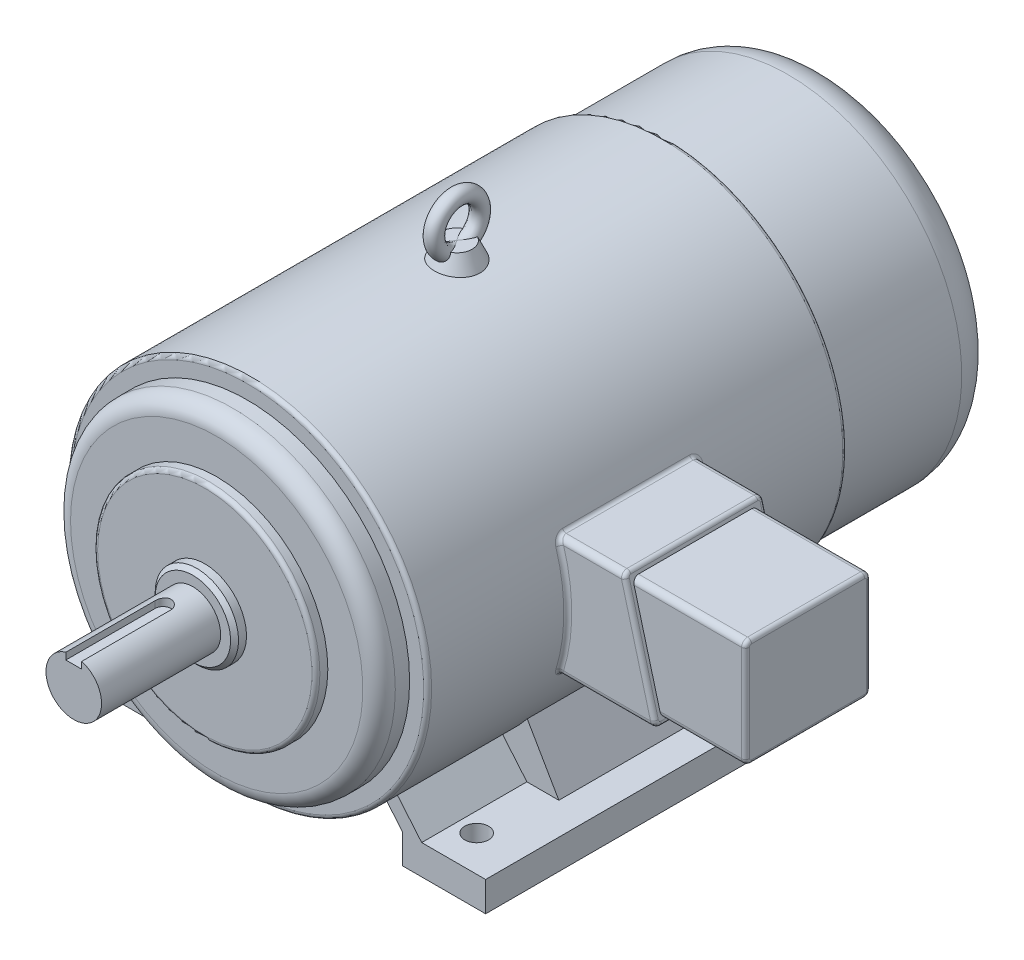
SolidWorks part; units mm, degrees
ref_plane "FRONT" through (0, 0, 0) normal (0, 0, 1) x (1, 0, 0)
ref_plane "TOP" through (0, 0, 0) normal (0, 1, 0) x (1, 0, 0)
ref_plane "RIGHT" through (0, 0, 0) normal (1, 0, 0) x (0, 0, -1)
sketch "Sketch1" plane through (0, 0, 0) normal (0, 0, 1) x (1, 0, 0)
  line L0 (-193, 0) -> (193, 0) construction
  line L1 (0, 103.8215) -> (0, -109.7499) construction
  line L2 (-105.6, -81.8182) -> (-121, -81.8182)
  line L3 (-105.6, 90.9091) -> (105.6, 90.9091)
  line L4 (-105.6, 90.9091) -> (-105.6, 81.8182)
  line L5 (-105.6, -90.9091) -> (105.6, -90.9091)
  line L6 (105.6, 90.9091) -> (105.6, -90.9091)
  line L7 (-121, -81.8182) -> (-121, -56)
  line L8 (-121, -56) -> (-127, -56)
  line L9 (-127, -56) -> (-127, -21)
  line L10 (-127, -21) -> (-133, -21)
  line L11 (-133, -21) -> (-133, -14)
  line L12 (-133, -14) -> (-193, -14)
  line L13 (-193, -14) -> (-193, 14)
  line L14 (-193, 14) -> (-133, 14)
  line L15 (-133, 14) -> (-133, 21)
  line L16 (-133, 21) -> (-127, 21)
  line L17 (-127, 21) -> (-127, 56)
  line L18 (-127, 56) -> (-121, 56)
  line L19 (-121, 56) -> (-121, 81.8182)
  line L20 (-121, 81.8182) -> (-105.6, 81.8182)
  line L21 (105.6, 90.9091) -> (187, 90.9091)
  line L22 (187, 90.9091) -> (187, 21)
  line L23 (187, -21) -> (193, -21)
  line L24 (193, -21) -> (193, 21)
  line L25 (193, 21) -> (187, 21)
  line L26 (-105.6, 87.4091) -> (187, 87.4091)
  line L27 (187, -90.9091) -> (105.6, -90.9091)
  line L28 (-105.6, -81.8182) -> (-105.6, -90.9091)
  line L29 (193, -14) -> (193, 14)
  line L30 (-133, 14) -> (193, 14) construction
  line L31 (193, -14) -> (-133, -14) construction
  line L32 (-88, -90.9091) -> (-88, -100)
  line L33 (-88, -100) -> (88, -100)
  line L34 (88, -100) -> (88, -90.9091)
  line L35 (-70, -90.9091) -> (-70, -100) construction
  line L36 (70, -90.9091) -> (70, -100) construction
  line L37 (-76, -90.9091) -> (-76, -100)
  line L40 (187, -21) -> (187, -90.9091)
  circle A0 centre (0, 124.7159) radius 20.2841
  dimension "D16" = 245
  dimension "D17" = 40.5682
  dimension "D1" = 181.8182
  dimension "D2" = 63
  dimension "D3" = 380
  dimension "D4" = 28
  dimension "D5" = 42
  dimension "D6" = 112
  dimension "D7" = 163.6364
  dimension "D8" = 60
  dimension "D9" = 6
  dimension "D10" = 176
  dimension "D11" = 211.2
  dimension "D12" = 140
  dimension "H" = 100
  dimension "D14" = 3.5
  dimension "D15" = 12
sketch "Sketch2" plane through (0, 0, 0) normal (0, 0, 1) x (1, 0, 0)
  line L0 (-193, 0) -> (193, 0) construction
  line L1 (193, -21) -> (193, 21) construction
  line L2 (193, 21) -> (187, 21) construction
  line L3 (187, 90.9091) -> (187, 21) construction
  line L4 (-133, 19) -> (-131, 21)
  line L5 (-105.6, 90.9091) -> (105.6, 90.9091) construction
  line L6 (-105.6, 90.9091) -> (-105.6, 81.8182) construction
  line L7 (-121, 81.8182) -> (-105.6, 81.8182) construction
  line L8 (-121, 56) -> (-121, 81.8182) construction
  line L9 (-127, 56) -> (-121, 56) construction
  line L10 (-127, 21) -> (-127, 56) construction
  line L11 (-133, 21) -> (-127, 21) construction
  line L12 (-133, 14) -> (-133, 21) construction
  line L13 (-193, -14) -> (-193, 14) construction
  line L14 (-193, 14) -> (-133, 14) construction
  line L15 (193, 0) -> (193, 19)
  line L16 (191, 21) -> (187, 21)
  line L17 (187, 67.4091) -> (187, 21)
  line L18 (-105.6, 87.4091) -> (187, 87.4091) construction
  line L19 (-103.6, 90.9091) -> (103.6, 90.9091)
  line L20 (-105.6, 88.9091) -> (-105.6, 81.8182)
  line L21 (-112.8182, 81.8182) -> (-105.6, 81.8182)
  line L22 (-121, 56) -> (-121, 73.6364)
  line L23 (-125, 56) -> (-121, 56)
  line L24 (-127, 21) -> (-127, 54)
  line L25 (-131, 21) -> (-127, 21)
  line L26 (-133, 14) -> (-133, 19)
  line L27 (-193, 0) -> (-193, 14)
  line L28 (-193, 14) -> (-133, 14)
  line L29 (193, 0) -> (-193, 0)
  line L30 (105.6, 90.9091) -> (105.6, -90.9091) construction
  line L31 (105.6, 87.4091) -> (167, 87.4091)
  line L33 (105.6, 88.9091) -> (105.6, 87.4091)
  arc A0 (-121, 73.6364) -> (-112.8182, 81.8182) centre (-112.8182, 73.6364) cw
  arc A1 (187, 67.4091) -> (167, 87.4091) centre (167, 67.4091) ccw
  arc A2 (105.6, 88.9091) -> (103.6, 90.9091) centre (103.6, 88.9091) ccw
  arc A3 (-125, 56) -> (-127, 54) centre (-125, 54) ccw
  arc A4 (193, 19) -> (191, 21) centre (191, 19) ccw
  arc A5 (-103.6, 90.9091) -> (-105.6, 88.9091) centre (-103.6, 88.9091) ccw
  dimension "D1" = 8.1818
  dimension "D2" = 20
  dimension "D3" = 2
  dimension "D6" = 2
  dimension "D4" = 2
  dimension "D5" = 45
revolve "Revolve1" add sketch "Sketch2" angle 360 about L29
sketch "Sketch3" plane through (0, 0, 0) normal (1, 0, 0) x (0, 0, -1)
  line L0 (0, 109.3479) -> (0, -119.3861) construction
  line L1 (0, 103.8215) -> (0, -109.7499) construction
  line L2 (102.5, -85) -> (24.6466, 7.7821)
  line L3 (60.5, -85) -> (102.5, -85) construction
  line L4 (60.5, -85) -> (60.5, -100)
  line L5 (60.5, -100) -> (102.5, -100)
  line L6 (102.5, -85) -> (102.5, -100)
  line L7 (60.5, -85) -> (0, -12.8989)
  line L8 (80, -85) -> (80, -100)
  line L9 (0, -12.8989) -> (24.6466, 7.7821)
  line L10 (75, -85) -> (75, -100)
  line L11 (80, -60.298) -> (80, -84.1782) construction
  line L12 (85, -85) -> (85, -100)
  line L13 (0, 0) -> (125.2928, 0) construction
  line L14 (90.9091, 30.303) -> (-180, 30.303)
  line L15 (90.9091, 30.303) -> (90.9091, -30.303)
  line L16 (90.9091, -30.303) -> (-180, -30.303)
  line L17 (-180, 30.303) -> (-180, -30.303)
  circle A1 centre (0, 0) radius 90.9091 construction
  dimension "D1" = 15
  dimension "D2" = 205
  dimension "D3" = 42
  dimension "D4" = 50
  dimension "D5" = 160
  dimension "D6" = 10
  dimension "D7" = 180
  dimension "D8" = 60.6061
sketch "Sketch10" plane through (0, 0, 0) normal (1, 0, 0) x (0, 0, -1)
  line L0 (60.5, -100) -> (102.5, -100) construction
  line L1 (60.5, -85) -> (60.5, -100) construction
  line L2 (60.5, -85) -> (0, -12.8989) construction
  line L3 (102.5, -85) -> (102.5, -100) construction
  line L4 (102.5, -85) -> (102.5, -100)
  line L5 (60.5, -85) -> (0, -12.8989)
  line L6 (60.5, -85) -> (60.5, -100)
  line L7 (60.5, -100) -> (102.5, -100)
  line L8 (60.5, -85) -> (102.5, -85) construction
  line L9 (70.2906, -85) -> (102.5, -85)
  line L10 (70.2906, -85) -> (0, -1.231)
  line L11 (0, -56) -> (0, -21) construction
  line L12 (0, -1.231) -> (0, -12.8989) construction
  line L13 (-70.2906, -85) -> (0, -1.231)
  line L14 (-70.2906, -85) -> (-102.5, -85)
  line L15 (-60.5, -100) -> (-102.5, -100)
  line L16 (-60.5, -85) -> (-60.5, -100)
  line L17 (-60.5, -85) -> (0, -12.8989)
  line L18 (-102.5, -85) -> (-102.5, -100)
  dimension "D1" = 7.5
extrude "Extrude1" add sketch "Sketch10" along normal up to vertex and the other way up to vertex
sketch "Sketch11" plane through (0, 0, 0) normal (1, 0, 0) x (0, 0, -1)
  line L0 (102.5, -85) -> (70.2906, -85) construction
  line L1 (70.2906, -85) -> (57.8269, -70.1464) construction
  line L2 (-57.8269, -70.1464) -> (-70.2906, -85) construction
  line L3 (-70.2906, -85) -> (-102.5, -85) construction
  line L4 (102.5, -85) -> (70.2906, -85) construction
  line L5 (70.2906, -85) -> (57.8269, -70.1464)
  line L6 (-57.8269, -70.1464) -> (-70.2906, -85)
  line L7 (-70.2906, -85) -> (-102.5, -85) construction
  line L8 (-86.3953, -85) -> (-70.4752, -57.4257)
  line L9 (86.3953, -85) -> (70.4752, -57.4257)
  line L10 (0, 109.3479) -> (0, -119.3861) construction
  line L11 (-70.2906, -85) -> (-86.3953, -85)
  line L13 (86.3953, -85) -> (70.2906, -85)
  arc A1 (57.8269, -70.1464) -> (70.4752, -57.4257) centre (0, 0) ccw
  arc A2 (-70.4752, -57.4257) -> (-57.8269, -70.1464) centre (0, 0) ccw
  circle A3 centre (0, 0) radius 90.9091 construction
  dimension "D1" = 60
extrude "Extrude2" add sketch "Sketch11" along normal mid plane 70
sketch "Sketch12" plane through (0, -100, 0) normal (0, -1, 0) x (1, 0, 0)
  line L0 (160, 0) -> (-160, 0) construction
  line L1 (-133, 0) -> (193, 0) construction
  line L2 (-193, 0) -> (-133, 0) construction
  line L3 (0, -135.376) -> (0, 116.8683) construction
  line L4 (70, 80) -> (70, -80) construction
  line L5 (70, -80) -> (-70, -80) construction
  line L6 (-70, -80) -> (-70, 80) construction
  line L7 (-70, 80) -> (70, 80) construction
  circle A0 centre (70, 80) radius 6
  circle A1 centre (70, -80) radius 6
  circle A2 centre (-70, -80) radius 6
  circle A3 centre (-70, 80) radius 6
  dimension "D1" = 12
extrude "Cut-Extrude1" cut sketch "Sketch12" against normal up to surface (15 mm away)
sketch "Sketch13" plane through (0, 0, 0) normal (0, 0, 1) x (1, 0, 0)
  line L0 (0, 103.8215) -> (0, -109.7499) construction
  line L1 (-105.6, 90.9091) -> (105.6, 90.9091) construction
  line L4 (0, 98.6091) -> (-7.7, 98.6091) construction
  line L8 (-7.7, 98.6091) -> (-14.8811, 83.2091) construction
  line L9 (-14.8811, 83.2091) -> (0, 83.2091) construction
  line L11 (0, 83.2091) -> (0, 90.9091) construction
  line L12 (0, 90.9091) -> (0, 98.6091) construction
  line L14 (0, 98.6091) -> (0, 106.3091) construction
  circle A0 centre (0, 106.3091) radius 15.4 construction
  circle A1 centre (0, 106.3091) radius 7.7 construction
  point P9 (-7.7, 106.3091)
  dimension "D2" = 30.8
  dimension "D1" = 25
sketch "Sketch14" plane through (0, 0, 0) normal (0, 0, 1) x (1, 0, 0)
  line L0 (0, 98.6091) -> (-7.7, 98.6091)
  line L3 (-7.7, 98.6091) -> (-14.8811, 83.2091)
  line L4 (-14.8811, 83.2091) -> (0, 83.2091)
  line L5 (0, 83.2091) -> (0, 98.6091)
revolve "Revolve4" add sketch "Sketch14" angle 360 about L5
sketch "Sketch15" plane through (0, 0, 0) normal (1, 0, 0) x (0, 0, -1)
  line L0 (-17.3036, 106.3091) -> (0, 106.3091) construction
  line L1 (0, 103.8215) -> (0, -109.7499) construction
  line L3 (0, 90.9091) -> (0, 98.6091) construction
  circle A0 centre (0, 94.7591) radius 3.85
revolve "Revolve5" add sketch "Sketch15" angle 360 about L0
ref_plane "Plane1" through (0, 0, 0) normal (1, 0, 0) x (0, 0, -1)
sketch "Sketch16" plane through (0, 0, 0) normal (1, 0, 0) x (0, 0, -1)
  line L0 (90.9091, -30.303) -> (-180, -30.303) construction
  line L2 (90.9091, 30.303) -> (-180, 30.303) construction
  line L3 (0, -30.303) -> (-90.9091, -30.303)
  line L4 (-135.4545, -30.303) -> (-90.9091, -30.303)
  line L5 (0, 30.303) -> (-119.2152, 30.303)
  line L6 (0, 30.303) -> (0, -30.303)
  line L7 (0, 109.3479) -> (0, -119.3861) construction
  line L8 (-90.9091, 30.303) -> (-90.9091, -30.303) construction
  line L9 (-180, -30.303) -> (-90.9091, -30.303) construction
  line L10 (-135.4545, -30.303) -> (-119.2152, 30.303)
  circle A1 centre (0, 0) radius 90.9091 construction
  dimension "D1" = 75
extrude "Extrude3" add sketch "Sketch16" along normal mid plane 70
sketch "Sketch17" plane through (0, 0, 0) normal (1, 0, 0) x (0, 0, -1)
  line L4 (-119.2152, 30.303) -> (-135.4545, -30.303) construction
  line L5 (-120.0272, 27.2727) -> (-134.6426, -27.2727)
  line L8 (87.8788, 27.2727) -> (-176.9697, 27.2727)
  line L9 (-176.9697, 27.2727) -> (-176.9697, -27.2727)
  line L10 (-176.9697, -27.2727) -> (87.8788, -27.2727)
  line L11 (87.8788, -27.2727) -> (87.8788, 27.2727)
  line L12 (-120.0272, 27.2727) -> (-176.9697, 27.2727)
  line L13 (-176.9697, 27.2727) -> (-176.9697, -27.2727)
  line L14 (-176.9697, -27.2727) -> (-134.6426, -27.2727)
  dimension "D1" = 3.0303
extrude "Extrude4" add sketch "Sketch17" along normal mid plane 63
sketch "Sketch18" plane through (0, 0, 0) normal (1, 0, 0) x (0, 0, -1)
  line L0 (-155.8061, -27.2727) -> (-155.8061, 32.1303) construction
  line L1 (-176.9697, -27.2727) -> (-134.6426, -27.2727) construction
  line L2 (-161.0009, -27.2727) -> (-161.0009, -35.9307)
  line L3 (-161.0009, -35.9307) -> (-158.923, -35.9307)
  line L4 (-158.923, -35.9307) -> (-158.923, -31.6017)
  line L5 (-158.923, -31.6017) -> (-155.8061, -31.6017)
  line L6 (-161.0009, -27.2727) -> (-155.8061, -27.2727)
  line L7 (-155.8061, -27.2727) -> (-155.8061, -31.6017)
  dimension "D1" = 10.3896
  dimension "D2" = 6.2338
  dimension "D3" = 8.658
revolve "Revolve6" add sketch "Sketch18" angle 360 about L0
ref_plane "Plane2" through (0, 14, 0) normal (0, 1, 0) x (-1, 0, 0)
ref_plane "Plane3" through (0, -14, 0) normal (0, 1, 0) x (-1, 0, 0)
ref_plane "Plane4" through (0, 10, 0) normal (0, 1, 0) x (-1, 0, 0)
sketch "Sketch19" plane through (0, 14, 0) normal (0, 1, 0) x (-1, 0, 0)
  line L0 (-141.599, 0) -> (172.1237, 0) construction
  line L1 (193, -14) -> (193, 14) construction
  line L2 (148, 4) -> (193, 4)
  line L3 (148, 4) -> (148, -4) construction
  line L4 (148, -4) -> (193, -4)
  line L5 (193, 4) -> (193, -4)
  arc A0 (148, 4) -> (148, -4) centre (148, 0) ccw
  dimension "D1" = 8
  dimension "D2" = 45
extrude "Cut-Extrude2" cut sketch "Sketch19" against normal up to surface (4 mm away)
fillet "Fillet2" radius 1 2 edges at (0, -35.9307, 150.6113) (0, -27.2727, 161.0009)
fillet "Fillet3" radius 3 8 edges at (-31.5, -27.2727, 155.8061) (31.5, -27.2727, 155.8061) (31.5, 27.2727, 148.4984) (-31.5, 27.2727, 148.4984) (35, -30.303, 110.5822) (-35, -30.303, 110.5822) (35, 30.303, 102.4626) (-35, 30.303, 102.4626)
fillet "Fillet4" radius 2 24 edges at (-34.1213, 29.4244, 119.4506) (0, 30.303, 119.2152) (34.1213, 29.4244, 119.4506) (35, 0, 127.3349) (34.1213, -29.4244, 135.2191) (0, -30.303, 135.4545) (-34.1213, -29.4244, 135.2191) (-30.6213, 26.394, 176.9697) (0, 27.2727, 176.9697) (30.6213, 26.394, 176.9697) (31.5, 0, 176.9697) (30.6213, -26.394, 176.9697) (0, -27.2727, 176.9697) (-30.6213, -26.394, 176.9697) (-33.7959, -29.7061, 85.9186) (0, -30.303, 85.7099) (34.28, -29.2527, 86.074) (35, 0, 90.9091) (33.7959, 29.7061, 85.9186) (0, 30.303, 85.7099) (-34.28, 29.2527, 86.074) (-35, 0, 127.3349) (-31.5, 0, 176.9697) (-35, 0, 90.9091)
fillet "Fillet6" [suppressed] radius 2
fillet "Fillet7" [suppressed] radius 1.5
move or copy body "Body-Move/Copy1" bodies to move or copy 129 parameters "D6"=2
equation "\"D5@Sketch1\" = \"D4@Sketch1\" * 1.5"
equation "\"D6@Sketch1\" = \"D4@Sketch1\" * 4"
equation "\"D1@Sketch1\" = \"H@Sketch1\" / 0.55"
equation "\"D17@Sketch1\" = (  \"D16@Sketch1\" - \"H@Sketch1\" - \"H@Sketch1\" / 0.55 / 2 )  / 4 * 3"
equation "\"D7@Sketch1\" = \"D1@Sketch1\" * 0.9"
equation "\"D9@Sketch1\" = \"D8@Sketch1\" / 10"
equation "\"D10@Sketch1\"=\"D12@Sketch1\"+3*\"D15@Sketch1\""
equation "\"D11@Sketch1\" = \"D10@Sketch1\" * 1.2"
equation "\"D1@Sketch2\" = \"D7@Sketch1\" / 20"
equation "\"D8@Sketch3\" = \"D1@Sketch1\" / 3"
equation "\"D1@Sketch10\" = \"D1@Sketch3\" / 2"
equation "\"D1@Extrude2\" = \"D12@Sketch1\" *0.5"
equation "\"D1@Sketch12\" = \"D15@Sketch1\""
equation "\"D1@Sketch17\" = \"D8@Sketch3\" / 20"
equation "\"D1@Extrude3\"=\"D12@Sketch1\"*.5"
equation "\"D1@Extrude4\" = \"D1@Extrude3\" * 0.9"
equation "\"D3@Sketch18\" = \"D8@Sketch3\" / 7"
equation "\"D1@Sketch18\" = \"D3@Sketch18\" * 1.2"
equation "\"D2@Sketch18\" = \"D1@Sketch18\" * 0.6"
equation "\"D1@Plane2\" = \"D4@Sketch1\" / 2"
equation "\"D1@Plane3\" = \"D4@Sketch1\" / 2"
equation "\"D2@Sketch19\" = \"D8@Sketch1\" * 0.75"
equation "\"D2@Sketch13\" = \"D4@Sketch1\"*1.1"
